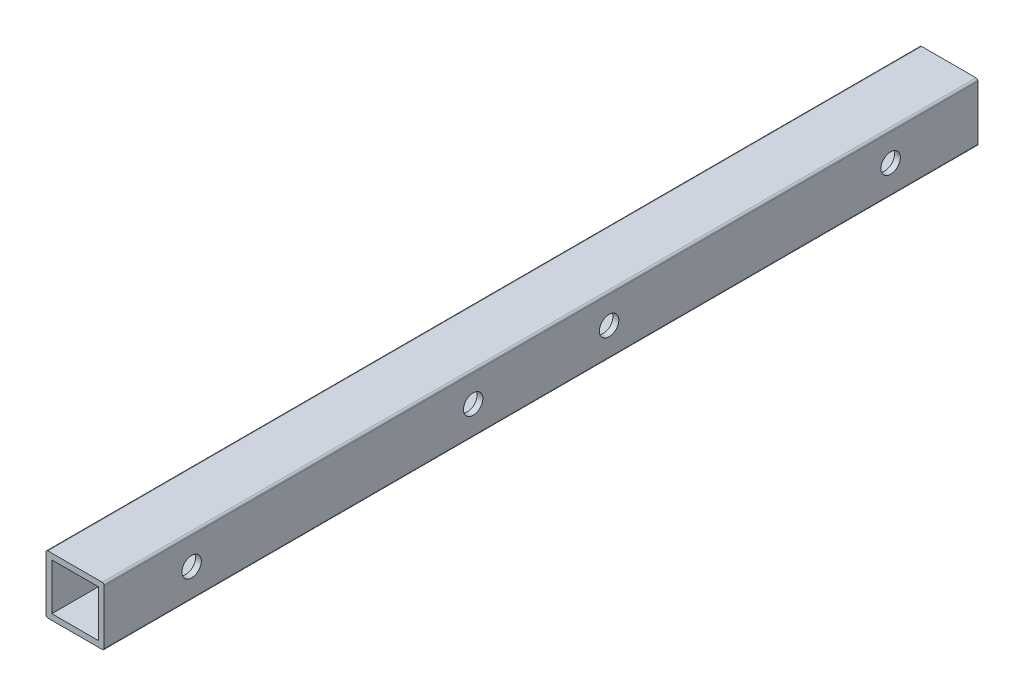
SolidWorks part; units mm, degrees
ref_plane "Plan1" through (0, 0, 0) normal (0, 0, 1) x (1, 0, 0)
ref_plane "Plan2" through (0, 0, 0) normal (0, 1, 0) x (1, 0, 0)
ref_plane "Plan3" through (0, 0, 0) normal (1, 0, 0) x (0, 0, -1)
sketch "Esquisse1" plane through (0, 0, 0) normal (0, 0, 1) x (1, 0, 0)
  line L0 (-14, 15) -> (14, 15)
  line L1 (-15, 14) -> (-15, -14)
  line L2 (14, -15) -> (-14, -15)
  line L3 (15, -14) -> (15, 14)
  line L4 (14, 14) -> (-14, -14) construction
  arc A0 (-14, -15) -> (-15, -14) centre (-14, -14) cw
  arc A1 (-15, 14) -> (-14, 15) centre (-14, 14) cw
  arc A2 (15, 14) -> (14, 15) centre (14, 14) ccw
  arc A3 (15, -14) -> (14, -15) centre (14, -14) cw
  dimension "D1" = 1
  dimension "D2" = 30
extrude "Base-Extru.-Mince" add sketch "Esquisse1" along normal blind 450 thin
sketch "Esquisse5" plane through (-15, 0, 0) normal (-1, 0, 0) x (0, 0, 1)
  line L1 (450, 14) -> (450, -14) construction
  circle A0 centre (405, 0) radius 5
  circle A1 centre (190, 0) radius 5
  circle A2 centre (260, 0) radius 5
  circle A3 centre (45, 0) radius 5
  dimension "D1" = 10
  dimension "D6" = 45
  dimension "D2" = 145
  dimension "D3" = 70
  dimension "D4" = 145
  dimension "D5" = 45
extrude "Enlèv. mat.-Extru.1" cut sketch "Esquisse5" against normal blind 40
